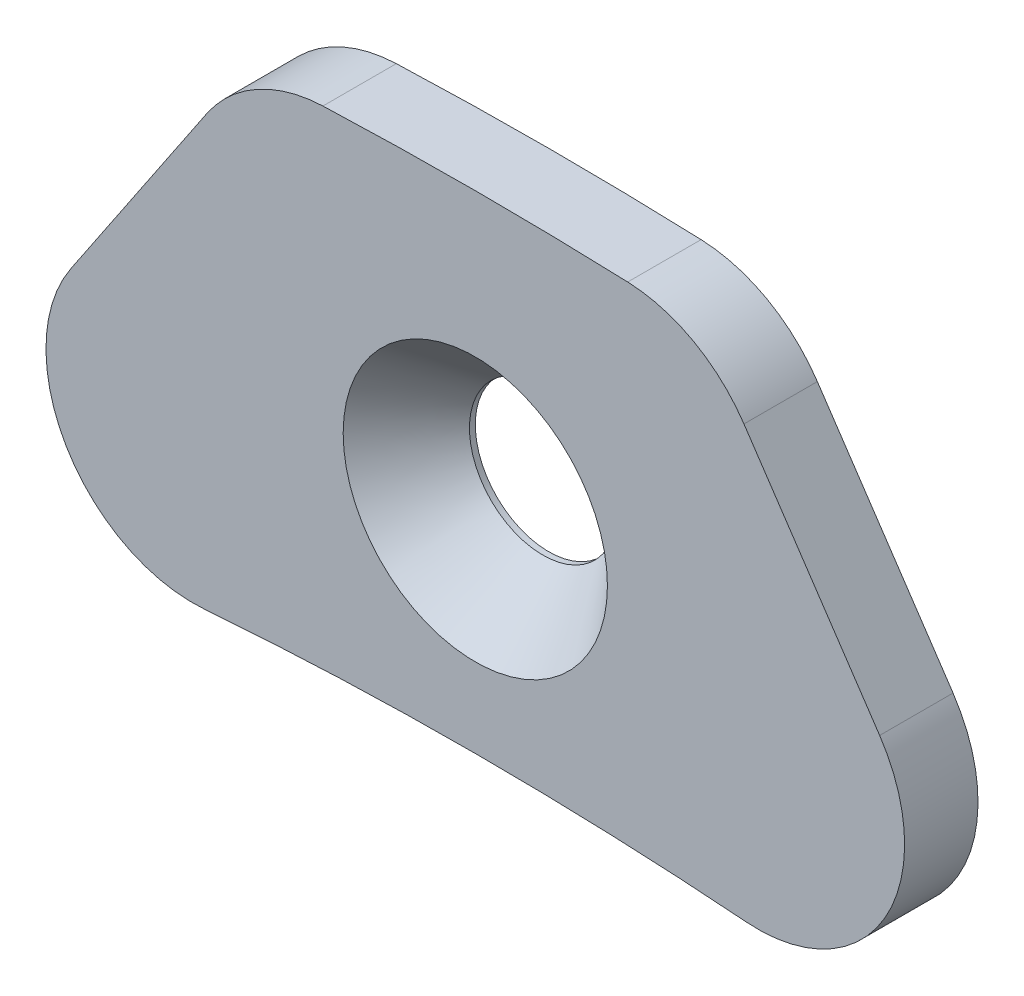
SolidWorks part; units mm, degrees
ref_plane "Front Plane" through (0, 0, 0) normal (0, 0, 1) x (1, 0, 0)
ref_plane "Top Plane" through (0, 0, 0) normal (0, 1, 0) x (1, 0, 0)
ref_plane "Right Plane" through (0, 0, 0) normal (1, 0, 0) x (0, 0, -1)
sketch "Sketch1" plane through (0, 0, 0) normal (0, 0, 1) x (1, 0, 0)
  line L0 (0, 0) -> (0, 113.1226) construction
  line L1 (5.8101, 85.2132) -> (8.7448, 80.8469)
  line L3 (-5.8101, 85.2132) -> (-8.7448, 80.8469)
  circle A0 centre (0, 0) radius 86.6775 construction
  circle A1 centre (0, 0) radius 80.7085 construction
  circle A2 centre (0, 80.7085) radius 1.5875
  circle A3 centre (0, 0) radius 76.1365 construction
  arc A4 (3.2957, 86.6148) -> (-3.2957, 86.6148) centre (0, 0) ccw
  arc A5 (5.8651, 75.9103) -> (-5.8651, 75.9103) centre (0, 0) ccw
  arc A6 (5.8101, 85.2132) -> (3.2957, 86.6148) centre (3.175, 83.4421) ccw
  arc A7 (-5.8101, 85.2132) -> (-3.2957, 86.6148) centre (-3.175, 83.4421) cw
  arc A8 (-5.8651, 75.9103) -> (-8.7448, 80.8469) centre (-6.1097, 79.0758) cw
  arc A9 (8.7448, 80.8469) -> (5.8651, 75.9103) centre (6.1097, 79.0758) cw
  point P17 (-4.9199, 86.5378)
  point P20 (-12.6184, 75.0836)
  point P23 (12.6184, 75.0836)
  dimension "D1" = 173.355
  dimension "D2" = 161.417
  dimension "D3" = 3.175
  dimension "D4" = 152.273
  dimension "D5" = 3.175
  dimension "D7" = 3.175
  dimension "D6" = 6.1097
extrude "Extrude1" add sketch "Sketch1" along normal blind 1.5875
chamfer "Chamfer1" distance 1.27 angle 49 1 edges at (1.5875, 80.7085, 1.5875)
